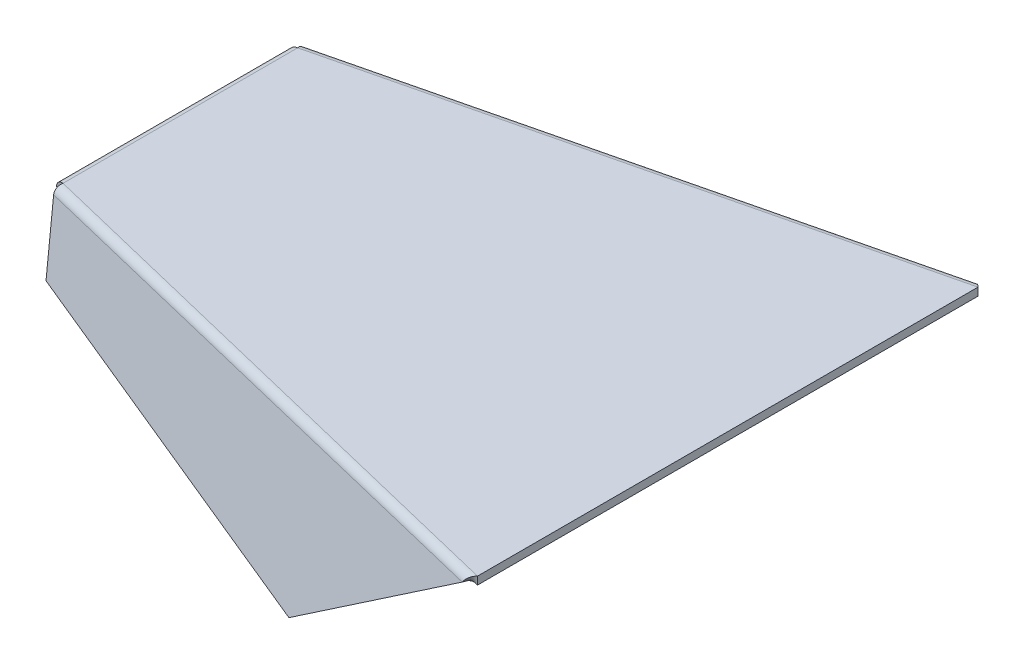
SolidWorks part; units mm, degrees
ref_plane "Front Plane" through (0, 0, 0) normal (0, 0, 1) x (1, 0, 0)
ref_plane "Top Plane" through (0, 0, 0) normal (0, 1, 0) x (1, 0, 0)
ref_plane "Right Plane" through (0, 0, 0) normal (1, 0, 0) x (0, 0, -1)
sketch "Sketch1" plane through (0, 0, 0) normal (0, 1, 0) x (1, 0, 0)
  line L0 (0, 0) -> (106, 0) construction
  line L1 (106, -32) -> (106, 32)
  line L2 (106, 32) -> (36, 15) construction
  line L3 (36, 15) -> (36, 0) construction
  line L4 (36, 15) -> (33.64, 24.7175)
  line L5 (33.64, 24.7175) -> (73.6395, 45.3341)
  line L6 (73.6395, 45.3341) -> (106, 32)
  line L7 (36, 15) -> (0, 6.2571)
  line L8 (0, 6.2571) -> (0, -6.2571)
  line L9 (36, -15) -> (0, -6.2571)
  line L10 (36, -15) -> (33.64, -24.7175)
  line L11 (33.64, -24.7175) -> (73.6395, -45.3341)
  line L12 (73.6395, -45.3341) -> (106, -32)
  circle A0 centre (12, 0) radius 4.25
  dimension "D2" = 8.5
  dimension "D10" = 12
  dimension "D1" = 90
  dimension "D3" = 32
  dimension "D4" = 10
  dimension "D5" = 35
  dimension "D6" = 45
  dimension "D7" = 70
  dimension "D8" = 36
  dimension "D9" = 15
sheet metal parameters "Sheet-Metal1" thickness 1 parameters "D1"=0.7366
base flange "Base-Flange1" sketch "Sketch1" thickness 1 reverse thickness direction no parameters "D1"=0.7366
sketch "Sketch3" plane through (0, 0, 0) normal (0, 1, 0) x (1, 0, 0)
  line L0 (36, 15) -> (106, 32)
  line L1 (36, -15) -> (106, -32)
sketched bend "Sketched Bend1" parameters "D1"=0.001
bend "SketchBend1" bend radius 0.001 bend angle 85 parameters "D5"=1
bend "SketchBend2" bend radius 0.001 bend angle 85 parameters "D5"=2
sketch "Sketch4" plane through (0, 0, 0) normal (0, 1, 0) x (1, 0, 0)
  line L0 (30, 13.5429) -> (30, -13.5429)
  line L1 (36, 15) -> (0, 6.2571) construction
  line L2 (0, -6.2571) -> (36, -15) construction
  line L3 (0, 6.2571) -> (0, -6.2571) construction
  dimension "D1" = 30
sketched bend "Sketched Bend2" parameters "D1"=0.001
bend "SketchBend3" bend radius 0.001 bend angle 75 parameters "D5"=3
sketch "Sketch5" plane through (0, 0, 0) normal (0, 1, 0) x (1, 0, 0)
  line L0 (36, 15) -> (36, -15)
sketched bend "Sketched Bend3" parameters "D1"=0.001
bend "SketchBend4" bend radius 0.001 bend angle 90 parameters "D5"=4
flat pattern "Flat-Pattern1"
sketch "Bend-Lines1" plane through (0, -1, 0) normal (0, -1, 0) x (1, 0, 0)
  line L0 (35.6065, -14.9044) -> (35.6065, 14.9044) construction
  line L1 (29.6721, -13.4632) -> (29.6721, 13.4632) construction
  line L2 (35.9123, 15.3611) -> (105.4161, 32.2406) construction
  line L3 (35.9123, -15.3611) -> (105.4161, -32.2406) construction
sketch3d "Bounding-Box1" [suppressed]
  line L0 (79.3195, 35.3776, 0) -> (-20.0111, -15.8194, 0) construction
  line L1 (41.0339, 109.6578, 0) -> (-58.2966, 58.4608, 0) construction
  line L2 (79.3195, 35.3776, 0) -> (41.0339, 109.6578, 0) construction
  line L3 (-20.0111, -15.8194, 0) -> (-58.2966, 58.4608, 0) construction
